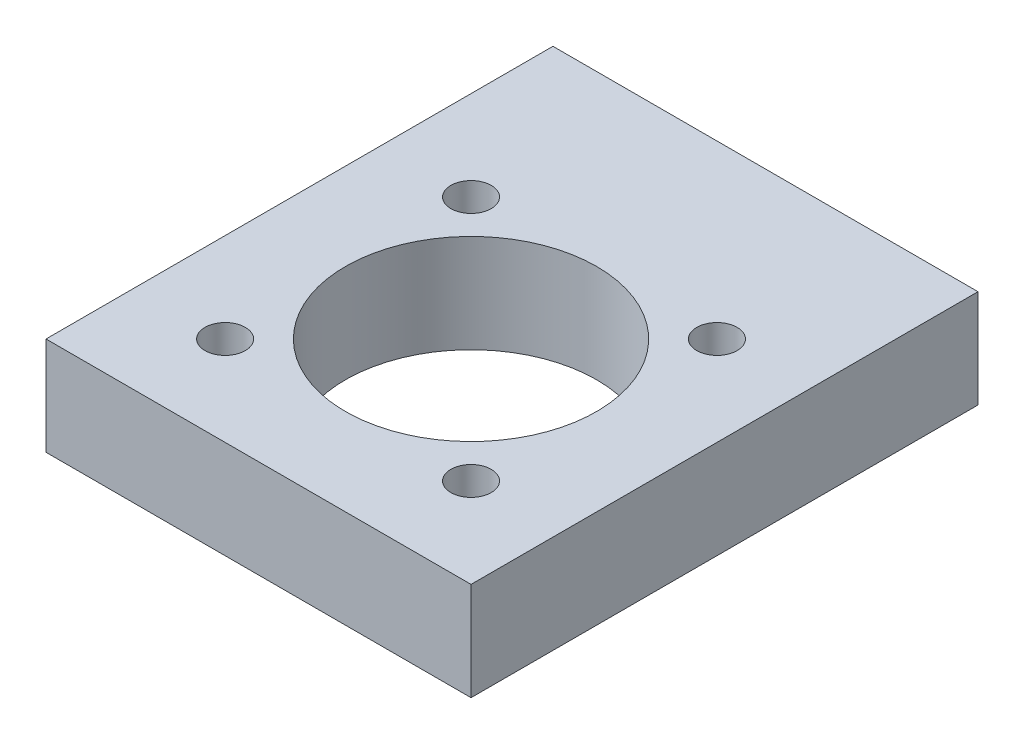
SolidWorks part; units mm, degrees
ref_plane "Front Plane" through (0, 0, 0) normal (0, 0, 1) x (1, 0, 0)
ref_plane "Top Plane" through (0, 0, 0) normal (0, 1, 0) x (1, 0, 0)
ref_plane "Right Plane" through (0, 0, 0) normal (1, 0, 0) x (0, 0, -1)
sketch "Sketch2" plane through (0, 0, 0) normal (0, 1, 0) x (1, 0, 0)
  line L0 (-27.5, 0) -> (-27.5, 38.1)
  line L1 (-27.5, 38.1) -> (27.5, 38.1)
  line L2 (27.5, 0) -> (27.5, 38.1)
  line L3 (-27.5, -27.5) -> (27.5, -27.5)
  line L4 (27.5, 0) -> (27.5, -27.5)
  line L5 (-27.5, -27.5) -> (-27.5, 0)
  arc A0 (-27.5, 0) -> (27.5, 0) centre (0, 0) ccw construction
  point P9 (0, -27.5)
  dimension "D1" = 55
  dimension "D2" = 38.1
extrude "Boss-Extrude1" add sketch "Sketch2" along normal blind 12.7
sketch "Sketch1" plane through (0, 0, 0) normal (0, 1, 0) x (1, 0, 0)
  line L0 (0, 0) -> (38.7669, 38.7669) construction
  line L1 (0, 0) -> (68.775, 0) construction
  line L2 (0, 0) -> (-35.9254, 35.9254) construction
  circle A0 centre (0, 0) radius 22.5 construction
  circle A1 centre (15.9099, 15.9099) radius 2.6099
  circle A5 centre (-15.9099, 15.9099) radius 2.6098
  circle A6 centre (15.9099, -15.9099) radius 2.6099
  circle A7 centre (-15.9099, -15.9099) radius 2.6098
  dimension "D1" = 45
  dimension "D2" = 5.2197
  dimension "D3" = 45
extrude "Cut-Extrude1" cut sketch "Sketch1" along normal up to next
sketch "Sketch3" plane through (0, 0, 0) normal (0, -1, 0) x (1, 0, 0)
  circle A0 centre (0, 0) radius 16.256
  dimension "D1" = 32.512
extrude "Cut-Extrude2" cut sketch "Sketch3" against normal up to next
sketch "Sketch4" plane through (0, 0, -38.1) normal (0, 0, -1) x (-1, 0, 0)
  line L1 (-40.2, 0) -> (40.2, 0)
  line L2 (-40.2, 0) -> (-40.2, 25.4)
  line L3 (-40.2, 25.4) -> (40.2, 25.4)
  line L4 (40.2, 0) -> (40.2, 25.4)
  point P4 (0, 0)
  dimension "D1" = 25.4
  dimension "D2" = 80.4
extrude "Boss-Extrude2" [suppressed] add sketch "Sketch4" against normal blind 6.35
sketch "Sketch5" plane through (0, 0, -38.1) normal (0, 0, -1) x (-1, 0, 0)
  line L0 (0, 0) -> (0, 25.2589) construction
  circle A2 centre (6.35, 6.35) radius 1.8986
  circle A3 centre (19.05, 6.35) radius 1.8986
  circle A4 centre (-19.05, 6.35) radius 1.8986
  circle A5 centre (-6.35, 6.35) radius 1.8986
  dimension "D3" = 3.7973
  dimension "D1" = 6.35
  dimension "D2" = 19.05
  dimension "D4" = 6.35
extrude "Cut-Extrude3" cut sketch "Sketch5" against normal blind 12.7
